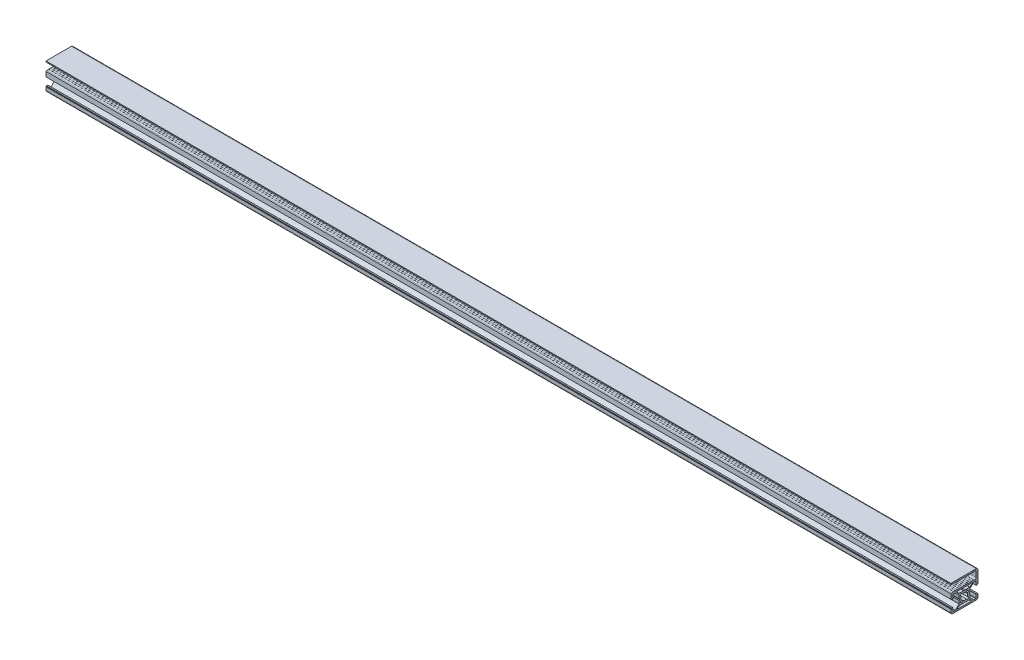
SolidWorks part; units mm, degrees
ref_plane "Ebene vorne" through (0, 0, 0) normal (0, 0, 1) x (1, 0, 0)
ref_plane "Ebene oben" through (0, 0, 0) normal (0, 1, 0) x (1, 0, 0)
ref_plane "Ebene rechts" through (0, 0, 0) normal (1, 0, 0) x (0, 0, -1)
sketch "Skizze1" plane through (0, 0, 0) normal (0, 1, 0) x (1, 0, 0)
  line L0 (0, 0) -> (1000, 0)
  dimension "D1" = 1000
other "Strukturbauteil1"
ref_plane "Ebene1" through (0, 0, 0) normal (1, 0, 0) x (0, 0, -1)
sketch "Model" plane through (0, 0, 0) normal (1, 0, 0) x (0, 0, -1)
  line L0 (-15, 15) -> (-15, 13.9)
  line L1 (-15, 5) -> (-15, -0.3)
  line L2 (-15, -9.7) -> (-15, -13)
  line L3 (-14.4, -0.3) -> (-14.4, -0.9)
  line L4 (-14.4, -9.1) -> (-14.4, -9.7)
  line L5 (-13, -15) -> (13, -15)
  line L6 (-12.8, -13.15) -> (-12.8, -9.3)
  line L7 (-12.8, -0.7) -> (-12.8, 3.15)
  line L8 (-7.864, -13.35) -> (7.864, -13.35)
  line L9 (10.2328, -13.35) -> (12.6, -13.35)
  line L10 (-10.2328, -13.35) -> (-12.6, -13.35)
  line L11 (-15, 5) -> (-14, 5.3944)
  line L12 (-5.8672, -10.9531) -> (-0.866, -10.9531)
  line L13 (0.866, -10.9531) -> (5.8672, -10.9531)
  line L14 (-15, -9.7) -> (-14.4, -9.7)
  line L15 (15, -9.7) -> (14.4, -9.7)
  line L16 (13, -9.1) -> (14.4, -9.1)
  line L17 (-13, -9.1) -> (-14.4, -9.1)
  line L18 (0.866, -10.9531) -> (0, -10.4531)
  line L19 (-5.4531, -5) -> (-5.95, -4.1394)
  line L20 (-5.95, -0.9328) -> (-5.95, -4.1394)
  line L21 (-5.95, -5.8606) -> (-5.95, -9.0672)
  line L22 (-10.0914, 3.2914) -> (-6.0086, -0.7914)
  line L23 (-4.5314, -1.8828) -> (-3.1893, -3.2249)
  line L24 (1.7751, -8.1893) -> (3.1172, -9.5314)
  line L25 (-8.6017, 3.5986) -> (-6.0086, 1.0055)
  line L26 (8.0055, -13.0086) -> (6.0086, -11.0117)
  line L27 (-5.95, -5.8606) -> (-5.4531, -5)
  line L28 (4.5314, -8.1172) -> (3.1893, -6.7751)
  line L29 (-1.7751, -1.8107) -> (-3.1172, -0.4686)
  line L30 (6.0086, -9.2086) -> (10.0914, -13.2914)
  line L31 (0, 0.4531) -> (0.8552, 0.9469)
  line L32 (-14.4, -0.9) -> (-13, -0.9)
  line L33 (14.4, -0.9) -> (13, -0.9)
  line L34 (-15, -0.3) -> (-14.4, -0.3)
  line L35 (15, -0.3) -> (14.4, -0.3)
  line L36 (5.8672, 0.9469) -> (0.8552, 0.9469)
  line L37 (-0.8552, 0.9469) -> (-5.8672, 0.9469)
  line L38 (-0.8552, 0.9469) -> (0, 0.4531)
  line L39 (-6.0086, -9.2086) -> (-10.0914, -13.2914)
  line L40 (3.1172, -0.4686) -> (1.7751, -1.8107)
  line L41 (-3.1893, -6.7751) -> (-4.5314, -8.1172)
  line L42 (5.4531, -5) -> (5.95, -5.8606)
  line L43 (-6.0086, -11.0117) -> (-8.0055, -13.0086)
  line L44 (6.0086, 1.0055) -> (8.6017, 3.5986)
  line L45 (8.2098, 5.4995) -> (9.7748, 5.6984)
  line L46 (-12.6, 3.35) -> (-10.2328, 3.35)
  line L47 (12.6, 3.35) -> (10.2328, 3.35)
  line L48 (8.4603, 3.94) -> (-8.4603, 3.94)
  line L49 (-3.1172, -9.5314) -> (-1.7751, -8.1893)
  line L50 (3.1893, -3.2249) -> (4.5314, -1.8828)
  line L51 (10.0914, 3.2914) -> (6.0086, -0.7914)
  line L52 (6.2342, 5.4818) -> (7.823, 5.6982)
  line L53 (4.2342, 5.4818) -> (5.823, 5.6982)
  line L54 (2.2342, 5.4818) -> (3.823, 5.6982)
  line L55 (0.2342, 5.4818) -> (1.823, 5.6982)
  line L56 (-1.7658, 5.4818) -> (-0.177, 5.6982)
  line L57 (10, 5.2) -> (11.3, 5.2)
  line L58 (5.95, -0.9328) -> (5.95, -4.1394)
  line L59 (5.95, -5.8606) -> (5.95, -9.0672)
  line L60 (5.95, -4.1394) -> (5.4531, -5)
  line L61 (-3.7658, 5.4818) -> (-2.177, 5.6982)
  line L62 (-5.7658, 5.4817) -> (-4.177, 5.6982)
  line L63 (-7.7658, 5.4818) -> (-6.177, 5.6982)
  line L64 (-9.7658, 5.4818) -> (-8.177, 5.6982)
  line L65 (-11.7658, 5.4818) -> (-10.177, 5.6982)
  line L66 (-14, 5.3944) -> (-12.1829, 5.6973)
  line L67 (-15, 13.9) -> (-14, 13.5056)
  line L68 (10, 13.7) -> (10, 13.4)
  line L69 (10, 5.5) -> (10, 5.2)
  line L70 (0, -10.4531) -> (-0.866, -10.9531)
  line L71 (-14, 13.5056) -> (-12.1829, 13.2027)
  line L72 (12.8, -13.15) -> (12.8, -9.3)
  line L73 (12.8, -0.7) -> (12.8, 3.15)
  line L74 (12.8, 6.7) -> (12.8, 12.2)
  line L75 (-11.7658, 13.4182) -> (-10.177, 13.2018)
  line L76 (-9.7658, 13.4182) -> (-8.177, 13.2018)
  line L77 (-7.7658, 13.4182) -> (-6.177, 13.2018)
  line L78 (-5.7658, 13.4182) -> (-4.177, 13.2018)
  line L79 (-3.7658, 13.4182) -> (-2.177, 13.2018)
  line L80 (10, 13.7) -> (11.3, 13.7)
  line L81 (8.2098, 13.4005) -> (9.7748, 13.2016)
  line L82 (-1.7658, 13.4182) -> (-0.177, 13.2018)
  line L83 (0.2342, 13.4182) -> (1.823, 13.2018)
  line L84 (2.2342, 13.4182) -> (3.823, 13.2018)
  line L85 (4.2342, 13.4182) -> (5.823, 13.2018)
  line L86 (6.2342, 13.4182) -> (7.823, 13.2018)
  line L87 (14.4, -0.3) -> (14.4, -0.9)
  line L88 (14.4, -9.1) -> (14.4, -9.7)
  line L89 (15, -13) -> (15, -9.7)
  line L90 (15, -0.3) -> (15, 13)
  line L91 (13, 15) -> (-15, 15)
  line L92 (15, 15) -> (-15, 15) construction
  line L93 (15, 15) -> (15, -15) construction
  line L94 (-15, 15) -> (-15, -15) construction
  line L95 (15, -15) -> (-15, -15) construction
  line L96 (-15, 15) -> (15, -15) construction
  line L97 (-15, -15) -> (15, 15) construction
  line L98 (-11.9766, 13.3004) -> (-11.9662, 13.3196)
  line L99 (-9.9766, 13.3004) -> (-9.9662, 13.3196)
  line L100 (-7.9766, 13.3004) -> (-7.9662, 13.3196)
  line L101 (-5.9766, 13.3004) -> (-5.9662, 13.3196)
  line L102 (-3.9766, 13.3004) -> (-3.9662, 13.3196)
  line L103 (-1.9766, 13.3004) -> (-1.9662, 13.3196)
  line L104 (0.0234, 13.3004) -> (0.0338, 13.3196)
  line L105 (2.0234, 13.3004) -> (2.0338, 13.3196)
  line L106 (4.0234, 13.3004) -> (4.0338, 13.3196)
  line L107 (6.0234, 13.3004) -> (6.0338, 13.3196)
  line L108 (8.021, 13.2962) -> (8.0318, 13.3152)
  line L109 (8.021, 5.6037) -> (8.0318, 5.5848)
  line L110 (6.0234, 5.5996) -> (6.0338, 5.5804)
  line L111 (4.0234, 5.5996) -> (4.0338, 5.5804)
  line L113 (2.0234, 5.5996) -> (2.0338, 5.5804)
  line L114 (0.0338, 5.5804) -> (0.0234, 5.5996)
  line L115 (-1.9766, 5.5996) -> (-1.9662, 5.5804)
  line L116 (-3.9662, 5.5804) -> (-3.9766, 5.5996)
  line L117 (-5.9662, 5.5803) -> (-5.9766, 5.5996)
  line L118 (-7.9662, 5.5804) -> (-7.9766, 5.5996)
  line L119 (-9.9766, 5.5996) -> (-9.9662, 5.5804)
  line L120 (-11.9662, 5.5804) -> (-11.9766, 5.5996)
  arc A0 (-11.7658, 13.4182) -> (-11.9662, 13.3196) centre (-11.7928, 13.22) ccw
  arc A1 (-10.177, 13.2018) -> (-9.9766, 13.3004) centre (-10.15, 13.4) ccw
  arc A2 (-9.7658, 13.4182) -> (-9.9662, 13.3196) centre (-9.7928, 13.22) ccw
  arc A3 (-8.177, 13.2018) -> (-7.9766, 13.3004) centre (-8.15, 13.4) ccw
  arc A4 (-7.7658, 13.4182) -> (-7.9662, 13.3196) centre (-7.7928, 13.22) ccw
  arc A5 (-6.177, 13.2018) -> (-5.9766, 13.3004) centre (-6.15, 13.4) ccw
  arc A6 (-5.7658, 13.4182) -> (-5.9662, 13.3196) centre (-5.7928, 13.22) ccw
  arc A7 (-4.177, 13.2018) -> (-3.9766, 13.3004) centre (-4.15, 13.4) ccw
  arc A8 (-3.7658, 13.4182) -> (-3.9662, 13.3196) centre (-3.7928, 13.22) ccw
  arc A9 (-2.177, 13.2018) -> (-1.9766, 13.3004) centre (-2.15, 13.4) ccw
  arc A10 (-1.7658, 13.4182) -> (-1.9662, 13.3196) centre (-1.7928, 13.22) ccw
  arc A11 (-1.9662, 5.5804) -> (-1.7658, 5.4818) centre (-1.7928, 5.68) ccw
  arc A12 (-1.9766, 5.5996) -> (-2.177, 5.6982) centre (-2.15, 5.5) ccw
  arc A13 (-3.9662, 5.5804) -> (-3.7658, 5.4818) centre (-3.7928, 5.68) ccw
  arc A14 (-3.9766, 5.5996) -> (-4.177, 5.6982) centre (-4.15, 5.5) ccw
  arc A15 (-5.9662, 5.5803) -> (-5.7658, 5.4817) centre (-5.7928, 5.6799) ccw
  arc A16 (-5.9766, 5.5996) -> (-6.177, 5.6982) centre (-6.15, 5.5) ccw
  arc A17 (-7.9662, 5.5804) -> (-7.7658, 5.4818) centre (-7.7928, 5.68) ccw
  arc A18 (-7.9766, 5.5996) -> (-8.177, 5.6982) centre (-8.15, 5.5) ccw
  arc A19 (-9.9662, 5.5804) -> (-9.7658, 5.4818) centre (-9.7928, 5.68) ccw
  arc A20 (-9.9766, 5.5996) -> (-10.177, 5.6982) centre (-10.15, 5.5) ccw
  arc A21 (-11.9662, 5.5804) -> (-11.7658, 5.4818) centre (-11.7928, 5.68) ccw
  arc A22 (-11.9766, 5.5996) -> (-12.1829, 5.6973) centre (-12.15, 5.5) ccw
  arc A23 (-12.1829, 13.2027) -> (-11.9766, 13.3004) centre (-12.15, 13.4) ccw
  arc A24 (-4.5314, -8.1172) -> (-3.1172, -9.5314) centre (0, -5) ccw
  arc A25 (-3.1172, -0.4686) -> (-4.5314, -1.8828) centre (0, -5) ccw
  arc A26 (3.1172, -9.5314) -> (4.5314, -8.1172) centre (0, -5) ccw
  arc A27 (4.5314, -1.8828) -> (3.1172, -0.4686) centre (0, -5) ccw
  arc A28 (-3.1893, -3.2249) -> (-3.1893, -6.7751) centre (0, -5) ccw
  arc A29 (-1.7751, -8.1893) -> (1.7751, -8.1893) centre (0, -5) ccw
  arc A30 (1.7751, -1.8107) -> (-1.7751, -1.8107) centre (0, -5) ccw
  arc A31 (3.1893, -6.7751) -> (3.1893, -3.2249) centre (0, -5) ccw
  arc A32 (-0.177, 13.2018) -> (0.0234, 13.3004) centre (-0.15, 13.4) ccw
  arc A33 (0.2342, 13.4182) -> (0.0338, 13.3196) centre (0.2072, 13.22) ccw
  arc A34 (1.823, 13.2018) -> (2.0234, 13.3004) centre (1.85, 13.4) ccw
  arc A35 (2.2342, 13.4182) -> (2.0338, 13.3196) centre (2.2072, 13.22) ccw
  arc A36 (3.823, 13.2018) -> (4.0234, 13.3004) centre (3.85, 13.4) ccw
  arc A37 (4.2342, 13.4182) -> (4.0338, 13.3196) centre (4.2072, 13.22) ccw
  arc A38 (5.823, 13.2018) -> (6.0234, 13.3004) centre (5.85, 13.4) ccw
  arc A39 (6.2342, 13.4182) -> (6.0338, 13.3196) centre (6.2072, 13.22) ccw
  arc A40 (7.823, 13.2018) -> (8.021, 13.2962) centre (7.85, 13.4) ccw
  arc A41 (9.7748, 13.2016) -> (10, 13.4) centre (9.8, 13.4) ccw
  arc A42 (10, 5.5) -> (9.7748, 5.6984) centre (9.8, 5.5) ccw
  arc A43 (8.021, 5.6037) -> (7.823, 5.6982) centre (7.85, 5.5) ccw
  arc A44 (6.0338, 5.5804) -> (6.2342, 5.4818) centre (6.2072, 5.68) ccw
  arc A45 (6.0234, 5.5996) -> (5.823, 5.6982) centre (5.85, 5.5) ccw
  arc A46 (4.0338, 5.5804) -> (4.2342, 5.4818) centre (4.2072, 5.68) ccw
  arc A47 (4.0234, 5.5996) -> (3.823, 5.6982) centre (3.85, 5.5) ccw
  arc A48 (2.0338, 5.5804) -> (2.2342, 5.4818) centre (2.2072, 5.68) ccw
  arc A49 (2.0234, 5.5996) -> (1.823, 5.6982) centre (1.85, 5.5) ccw
  arc A50 (0.0338, 5.5804) -> (0.2342, 5.4818) centre (0.2072, 5.68) ccw
  arc A51 (0.0234, 5.5996) -> (-0.177, 5.6982) centre (-0.15, 5.5) ccw
  arc A52 (8.2098, 13.4005) -> (8.0318, 13.3152) centre (8.1868, 13.22) ccw
  arc A53 (8.0318, 5.5848) -> (8.2098, 5.4995) centre (8.1868, 5.68) ccw
  arc A54 (15, 13) -> (13, 15) centre (13, 13) ccw
  arc A55 (15, -13) -> (13, -15) centre (13, -13) cw
  arc A56 (-15, -13) -> (-13, -15) centre (-13, -13) ccw
  arc A57 (12.8, 12.2) -> (11.3, 13.7) centre (11.3, 12.2) ccw
  arc A58 (12.8, 6.7) -> (11.3, 5.2) centre (11.3, 6.7) cw
  arc A59 (-7.864, -13.35) -> (-8.0055, -13.0086) centre (-7.864, -13.15) cw
  arc A60 (-6.0086, -11.0117) -> (-5.8672, -10.9531) centre (-5.8672, -11.1531) cw
  arc A61 (5.8672, -10.9531) -> (6.0086, -11.0117) centre (5.8672, -11.1531) cw
  arc A62 (8.0055, -13.0086) -> (7.864, -13.35) centre (7.864, -13.15) cw
  arc A63 (13, -9.1) -> (12.8, -9.3) centre (13, -9.3) ccw
  arc A64 (12.8, -13.15) -> (12.6, -13.35) centre (12.6, -13.15) cw
  arc A65 (10.2328, -13.35) -> (10.0914, -13.2914) centre (10.2328, -13.15) cw
  arc A66 (6.0086, -9.2086) -> (5.95, -9.0672) centre (6.15, -9.0672) cw
  arc A67 (5.95, -0.9328) -> (6.0086, -0.7914) centre (6.15, -0.9328) cw
  arc A68 (13, -0.9) -> (12.8, -0.7) centre (13, -0.7) cw
  arc A69 (12.8, 3.15) -> (12.6, 3.35) centre (12.6, 3.15) ccw
  arc A70 (10.0914, 3.2914) -> (10.2328, 3.35) centre (10.2328, 3.15) cw
  arc A71 (-6.0086, 1.0055) -> (-5.8672, 0.9469) centre (-5.8672, 1.1469) ccw
  arc A72 (5.8672, 0.9469) -> (6.0086, 1.0055) centre (5.8672, 1.1469) ccw
  arc A73 (8.6017, 3.5986) -> (8.4603, 3.94) centre (8.4603, 3.74) ccw
  arc A74 (-8.4603, 3.94) -> (-8.6017, 3.5986) centre (-8.4603, 3.74) ccw
  arc A75 (-13, -0.9) -> (-12.8, -0.7) centre (-13, -0.7) ccw
  arc A76 (-12.8, 3.15) -> (-12.6, 3.35) centre (-12.6, 3.15) cw
  arc A77 (-10.2328, 3.35) -> (-10.0914, 3.2914) centre (-10.2328, 3.15) cw
  arc A78 (-6.0086, -0.7914) -> (-5.95, -0.9328) centre (-6.15, -0.9328) cw
  arc A79 (-5.95, -9.0672) -> (-6.0086, -9.2086) centre (-6.15, -9.0672) cw
  arc A80 (-10.0914, -13.2914) -> (-10.2328, -13.35) centre (-10.2328, -13.15) cw
  arc A81 (-12.6, -13.35) -> (-12.8, -13.15) centre (-12.6, -13.15) cw
  arc A82 (-12.8, -9.3) -> (-13, -9.1) centre (-13, -9.3) ccw
  point P2 (0, 0)
  point P203 (12.8, 9.45)
  point P205 (15, -5)
  point P208 (-15, -5)
  point P209 (0, -15)
  point P210 (-15, 9.45)
  point P211 (0, -5)
